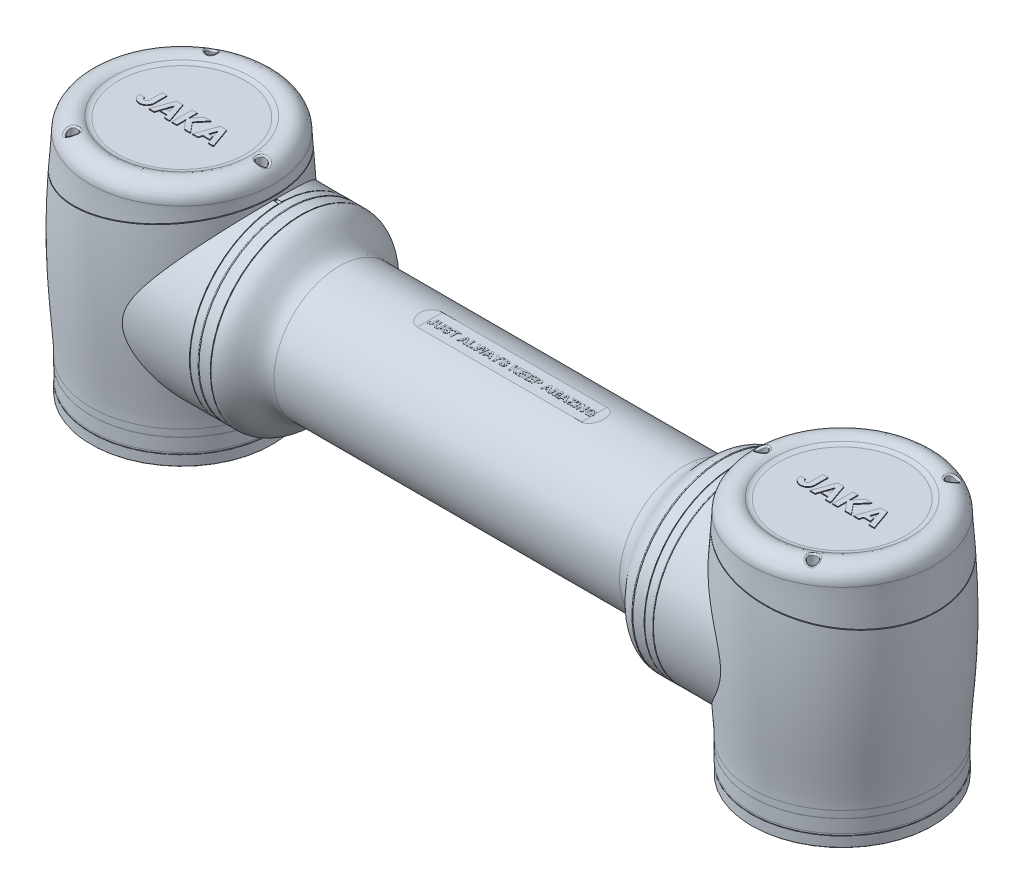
SolidWorks part; units mm, degrees
ref_plane "前视基准面" through (0, 0, 0) normal (0, 0, 1) x (1, 0, 0)
ref_plane "上视基准面" through (0, 0, 0) normal (0, 1, 0) x (1, 0, 0)
ref_plane "右视基准面" through (0, 0, 0) normal (1, 0, 0) x (0, 0, -1)
imported_body "01"
imported_body "02"
imported_body "03"
other "删除面3"
other "删除面4"
sketch "草图1" plane through (71.1479, 0, 0) normal (1, 0, 0) x (0, 0, -1)
  circle A0 centre (-154.7913, 133.5419) radius 1
  circle A1 centre (-154.7913, 74.5419) radius 59 construction
  dimension "D1" = 2
extrude "切除-拉伸1" cut sketch "草图1" against normal blind 3
sketch "草图2" plane through (373.1479, 0, 0) normal (-1, 0, 0) x (0, 0, 1)
  circle A0 centre (154.7913, 133.5419) radius 1
  circle A1 centre (154.7913, 74.5419) radius 59 construction
  dimension "D1" = 2
extrude "切除-拉伸2" cut sketch "草图2" against normal blind 3
ref_plane "基准面1" through (0, 10.842, 0) normal (0, -1, 0) x (-1, 0, 0)
sketch "草图3" plane through (0, 10.842, 0) normal (0, -1, 0) x (-1, 0, 0)
  circle A0 centre (-378.1479, -154.7913) radius 1
  circle A1 centre (-437.1479, -154.7913) radius 59 construction
  circle A2 centre (-66.1479, -154.7913) radius 1
  circle A3 centre (-7.1479, -154.7913) radius 59 construction
  dimension "D1" = 2
  dimension "D2" = 2
extrude "切除-拉伸3" cut sketch "草图3" against normal blind 3
